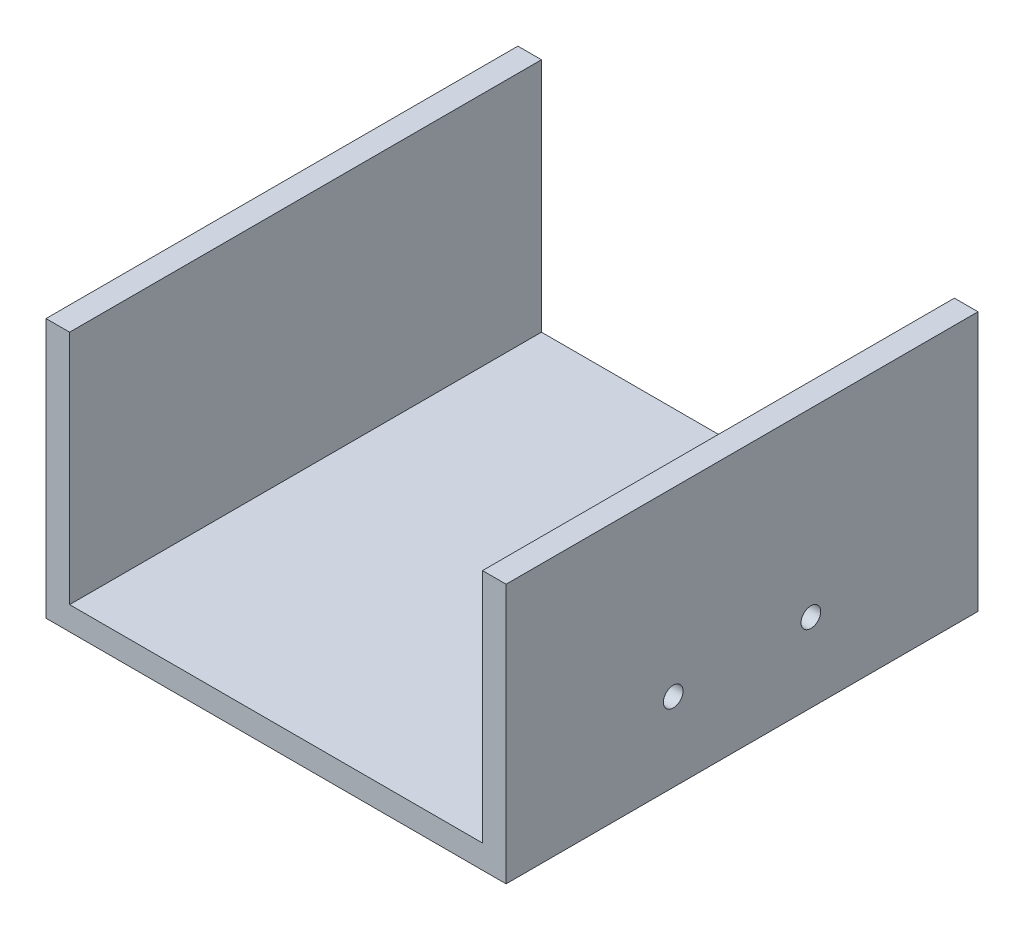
SolidWorks part; units mm, degrees
ref_plane "Plan de face" through (0, 0, 0) normal (0, 0, 1) x (1, 0, 0)
ref_plane "Plan de dessus" through (0, 0, 0) normal (0, 1, 0) x (1, 0, 0)
ref_plane "Plan de droite" through (0, 0, 0) normal (1, 0, 0) x (0, 0, -1)
sketch "Esquisse1" plane through (0, 0, 0) normal (0, 0, 1) x (1, 0, 0)
  line L0 (0, 43.4957) -> (0, -48.9817) construction
  line L1 (-68.153, 0) -> (64.6558, 0) construction
  line L2 (-52.5, -27) -> (52.5, -27)
  line L3 (52.5, -27) -> (52.5, 33)
  line L4 (52.5, 33) -> (58.5, 33)
  line L5 (58.5, 33) -> (58.5, -33)
  line L6 (58.5, -33) -> (-58.5, -33)
  line L7 (-52.5, 33) -> (-58.5, 33)
  line L8 (-52.5, -27) -> (-52.5, 33)
  line L9 (-58.5, 33) -> (-58.5, -33)
  point P10 (0, -27)
  point P15 (0, -33)
  dimension "D1" = 58.5
  dimension "D2" = 66
  dimension "D3" = 6
  dimension "D4" = 6
extrude "Extrusion1" add sketch "Esquisse1" along normal blind 120
hole_wizard "Trou taraudé M61" positions "Esquisse8" profile "Esquisse7" tap size "M6" standard "ISO"
sketch "Esquisse8" plane through (58.5, 0, 0) normal (1, 0, 0) x (0, 0, -1)
  line L0 (-60, 45.3544) -> (-60, -47.8405) construction
  line L2 (0, -33) -> (0, 33) construction
  line L3 (-120, -33) -> (-120, 33) construction
  line L4 (-128.0502, -13) -> (5.5725, -13) construction
  line L6 (-120, -33) -> (0, -33) construction
  line L7 (-42.5, -3.9762) -> (-42.5, -44.8594) construction
  line L9 (-77.5, -3.9762) -> (-77.5, -47.8405) construction
  point P0 (-42.5, -13)
  point P30 (-77.5, -13)
  dimension "D1" = 20
  dimension "D2" = 35
  dimension "D3" = 17.5
sketch "Esquisse7" plane through (58.5, -13, 42.5) normal (0, 1, 0) x (0, 0, -1)
  line L0 (0, 0) -> (0, 18.5022)
  line L1 (0, 18.5022) -> (2.5, 17)
  line L2 (2.5, 17) -> (2.5, 0)
  line L5 (2.5, 0) -> (0, 0)
  line L10 (0, 18.5022) -> (-2.5, 17) construction
  line L11 (0, -6.35) -> (0, 107.95) construction
  dimension "Diamètre du trou pour taraudage" = 5
  dimension "Profondeur du trou pour taraudage" = 17
  dimension "Angle de pointe" = 118
